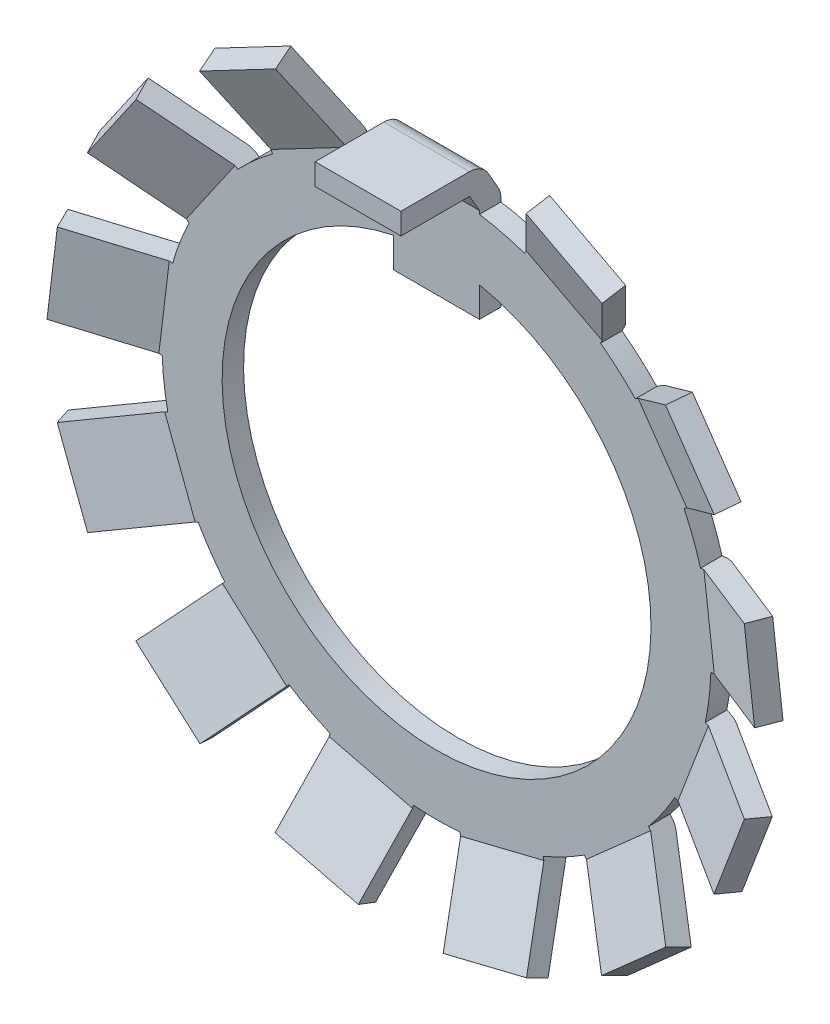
SolidWorks part; units mm, degrees
ref_plane "Face" through (0, 0, 0) normal (0, 0, 1) x (1, 0, 0)
ref_plane "Dessus" through (0, 0, 0) normal (0, 1, 0) x (1, 0, 0)
ref_plane "Droite" through (0, 0, 0) normal (1, 0, 0) x (0, 0, -1)
sketch "Esquisse1" plane through (0, 0, 0) normal (0, 0, 1) x (1, 0, 0)
  line L0 (0, -12.5) -> (0, 10.5) construction
  line L1 (-2.5, 10.5) -> (2.5, 10.5)
  line L2 (2.5, 10.5) -> (2.5, 12.2474)
  line L3 (-2.5, 10.5) -> (-2.5, 12.2474)
  line L4 (0, 0) -> (13, 0) construction
  arc A0 (-2.5, 12.2474) -> (2.5, 12.2474) centre (0, 0) ccw
  circle A1 centre (0, 0) radius 16
  dimension "dn" = 25
  dimension "d1" = 32
  dimension "f1" = 5
  dimension "M" = 23
  dimension "N" = 13
extrude "Base-Extrusion" add sketch "Esquisse1" along normal blind 1.25
ref_axis "Axe1" through (0, 0, -7.8059) along (0, 0, 1)
ref_plane "Plan1" through (0, 0, 0) normal (0.8855, 0.4647, 0) x (-0.4647, 0.8855, 0)
sketch "Esquisse2" plane through (0, 0, 0) normal (0.8855, 0.4647, 0) x (-0.4647, 0.8855, 0)
  line L0 (12.5, 0) -> (16, 0)
  line L1 (16.5283, 0.1171) -> (21, 2.2023)
  line L2 (0, 0) -> (0, 3) construction
  arc A0 (16, 0) -> (16.5283, 0.1171) centre (16, 1.25) ccw
  dimension "D3" = 1.25
  dimension "D1" = 12.5
  dimension "D2" = 16
  dimension "D4" = 25
  dimension "d5" = 42
extrude "Boss.-Extru.-Mince1" add sketch "Esquisse2" along normal mid plane 5 thin
pattern_circular "Répétition circulaire1" count 12 over 304.615 about axis through (0, 0, -7.8059) along (0, 0, 1) of "Boss.-Extru.-Mince1"
ref_plane "Plan2" through (0, 0, 0) normal (1, 0, 0) x (0, 0, -1)
sketch "Esquisse3" plane through (0, 0, 0) normal (1, 0, 0) x (0, 0, -1)
  line L0 (0, 12.5) -> (0, 16)
  line L1 (-0.1675, 16.625) -> (-0.7448, 17.625)
  line L2 (-1.8274, 18.25) -> (-5.8274, 18.25)
  arc A0 (0, 16) -> (-0.1675, 16.625) centre (-1.25, 16) ccw
  arc A1 (-0.7448, 17.625) -> (-1.8274, 18.25) centre (-1.8274, 17) ccw
  dimension "D1" = 1.25
  dimension "D2" = 30
  dimension "D3" = 12.5
  dimension "D4" = 16
  dimension "D5" = 4
  dimension "A" = 17
extrude "Boss.-Extru.-Mince2" add sketch "Esquisse3" along normal mid plane 5 thin
equation "\"teta@Plan1\"=360/\"N@Esquisse1\""
equation "\"D1@Esquisse2\" = \"dn@Esquisse1\"/2"
equation "\"D2@Esquisse2\" = \"d1@Esquisse1\"/2"
equation "\"D3@Esquisse2\" = \"e@Base-Extrusion\""
equation "\"e@Boss.-Extru.-Mince1\" = \"e@Base-Extrusion\""
equation "\"D1@Répétition circulaire1\" = \"N@Esquisse1\"-1"
equation "\"alpha@Répétition circulaire1\" = 360*(1-2/\"N@Esquisse1\")"
equation "\"beta@Plan2\" = \"teta@Plan1\""
equation "\"D1@Esquisse3\" = \"e@Base-Extrusion\""
equation "\"D3@Esquisse3\" = \"dn@Esquisse1\"/2"
equation "\"D4@Esquisse3\" = \"d1@Esquisse1\"/2"
equation "\"D5@Esquisse3\" = \"d5@Esquisse2\"/2-\"A@Esquisse3\""
equation "\"e@Boss.-Extru.-Mince2\" = \"e@Base-Extrusion\""
equation "\"g@Boss.-Extru.-Mince2\" = \"g@Boss.-Extru.-Mince1\""
